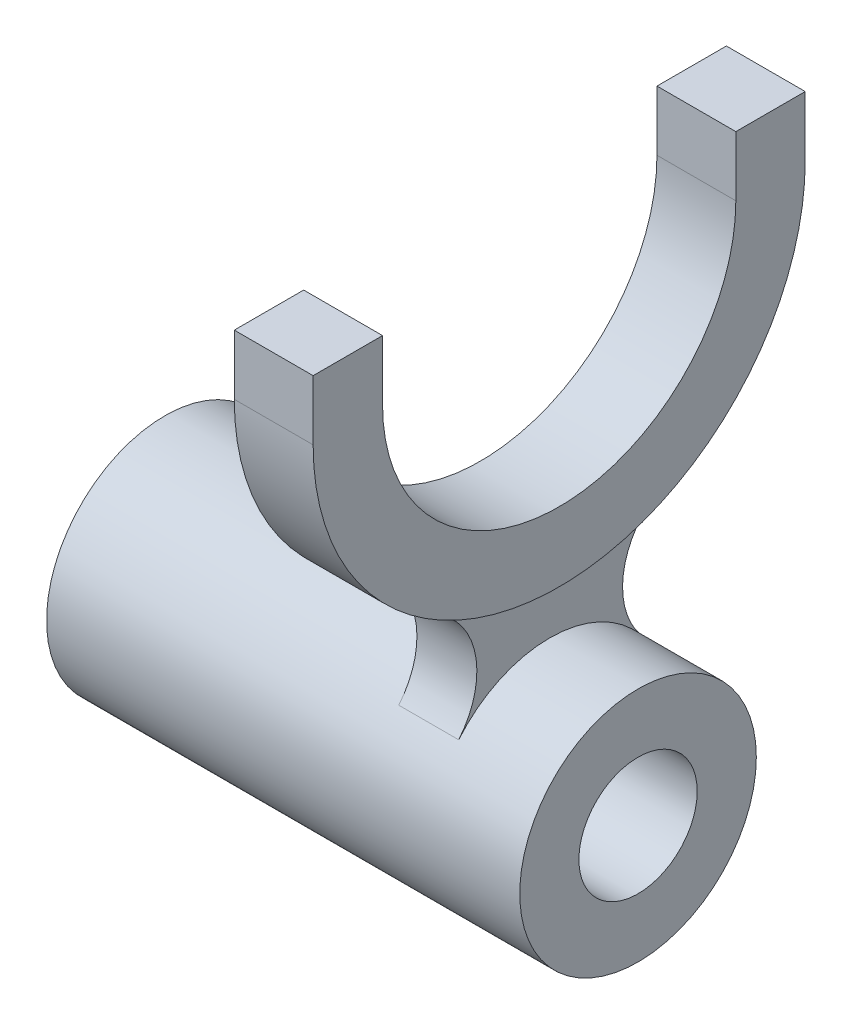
SolidWorks part; units mm, degrees
ref_plane "Front Plane" through (0, 0, 0) normal (0, 0, 1) x (1, 0, 0)
ref_plane "Top Plane" through (0, 0, 0) normal (0, 1, 0) x (1, 0, 0)
ref_plane "Right Plane" through (0, 0, 0) normal (1, 0, 0) x (0, 0, -1)
sketch "Sketch1" plane through (0, 0, 0) normal (1, 0, 0) x (0, 0, -1)
  circle A0 centre (0, 0) radius 9.525
  circle A1 centre (0, 0) radius 19.05
  dimension "D1" = 38.1
  dimension "D2" = 19.05
extrude "Boss-Extrude2" add sketch "Sketch1" along normal blind 19.05 and the other way blind 57.15
sketch "Sketch3" plane through (0, 0, 0) normal (1, 0, 0) x (0, 0, -1)
  line L0 (0, 0) -> (0, 66.548) construction
  line L1 (39.624, 66.548) -> (39.624, 76.2)
  line L2 (-39.624, 66.548) -> (-39.624, 76.2)
  arc A0 (-39.624, 66.548) -> (39.624, 66.548) centre (0, 66.548) ccw
  dimension "D2" = 39.624
  dimension "D1" = 66.548
  dimension "D3" = 9.652
extrude "Extrude-Thin1" add sketch "Sketch3" along normal mid plane 12.7 separate body thin
sketch "Sketch4" plane through (0, 0, 0) normal (1, 0, 0) x (0, 0, -1)
  arc A0 (-39.624, 66.548) -> (39.624, 66.548) centre (0, 66.548) ccw construction
  circle A1 centre (0, 0) radius 19.05 construction
  arc A2 (-18.5011, 31.5085) -> (18.5011, 31.5085) centre (0, 66.548) ccw
  arc A3 (14.6586, 12.1667) -> (-14.6586, 12.1667) centre (0, 0) ccw
  arc A4 (-14.6586, 12.1667) -> (-18.5011, 31.5085) centre (-24.431, 20.2778) ccw
  arc A5 (14.6586, 12.1667) -> (18.5011, 31.5085) centre (24.431, 20.2778) cw
  dimension "D1" = 12.7
extrude "Boss-Extrude3" add sketch "Sketch4" along normal mid plane 9.652
equation "\"A\"=1.56"
equation "\"B\"=1.5"
equation "\"C\"= 0.5"
equation "\"D\"= .75"
equation "\"D1@Sketch1\"=\"B\""
equation "\"D1@Extrude-Thin1\"=\"C\""
